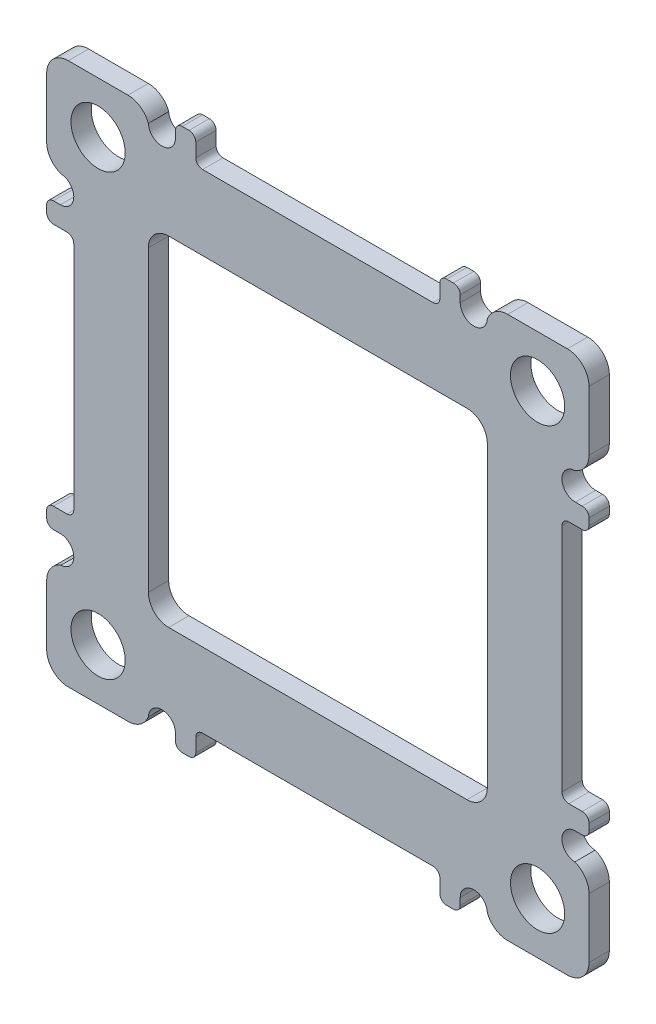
SolidWorks part; units mm, degrees
ref_plane "Front Plane" through (0, 0, 0) normal (0, 0, 1) x (1, 0, 0)
ref_plane "Top Plane" through (0, 0, 0) normal (0, 1, 0) x (1, 0, 0)
ref_plane "Right Plane" through (0, 0, 0) normal (1, 0, 0) x (0, 0, -1)
sketch "Sketch1" plane through (0, 0, 0) normal (0, 0, 1) x (1, 0, 0)
  line L0 (0, 0) -> (-40, -40) construction
  line L1 (-36.8039, 40) -> (-27.448, 40)
  line L2 (-40, 36.8039) -> (-40, 28.0026)
  line L3 (40, 20.0026) -> (40, 19.0026)
  line L4 (40, 36.8039) -> (40, 28.0026)
  line L5 (0, -40) -> (0, 40) construction
  line L6 (-40, 0) -> (40, 0) construction
  line L7 (22, 25) -> (-22, 25)
  line L8 (25, 22) -> (25, -22)
  line L9 (37, 18.0026) -> (39, 18.0026)
  line L10 (-25, 22) -> (-25, -22)
  line L11 (0, -25) -> (0, 25) construction
  line L12 (25, 0) -> (-25, 0) construction
  line L13 (37.9885, 21.0026) -> (39, 21.0026)
  line L14 (27.4643, 40) -> (36.8039, 40)
  line L15 (-20.0026, 40) -> (-19.0026, 40)
  line L16 (-36, 17.0026) -> (-36, -17.0026)
  line L17 (-18.0026, 37) -> (-18.0026, 39)
  line L18 (36, 17.0026) -> (36, -17.0026)
  line L19 (-21.0026, 37.9885) -> (-21.0026, 39)
  line L20 (21.0026, 37.9885) -> (21.0026, 39)
  line L21 (-17.0026, 36) -> (17.0026, 36)
  line L22 (18.0026, 37) -> (18.0026, 39)
  line L23 (20.0026, 40) -> (19.0026, 40)
  line L24 (-40, -20.0026) -> (-40, -19.0026)
  line L25 (-37, -18.0026) -> (-39, -18.0026)
  line L26 (-37.9885, -21.0026) -> (-39, -21.0026)
  line L27 (20.0026, -40) -> (19.0026, -40)
  line L28 (18.0026, -37) -> (18.0026, -39)
  line L29 (-17.0026, -36) -> (17.0026, -36)
  line L30 (-37.9885, 21.0026) -> (-39, 21.0026)
  line L31 (21.0026, -37.9885) -> (21.0026, -39)
  line L32 (-37, 18.0026) -> (-39, 18.0026)
  line L33 (-40, 20.0026) -> (-40, 19.0026)
  line L34 (-21.0026, -37.9885) -> (-21.0026, -39)
  line L35 (-18.0026, -37) -> (-18.0026, -39)
  line L36 (-20.0026, -40) -> (-19.0026, -40)
  line L37 (27.4643, -40) -> (36.8039, -40)
  line L38 (37.9885, -21.0026) -> (39, -21.0026)
  line L39 (37, -18.0026) -> (39, -18.0026)
  line L40 (22, -25) -> (-22, -25)
  line L41 (40, -36.8039) -> (40, -28.0026)
  line L42 (40, -20.0026) -> (40, -19.0026)
  line L43 (-40, -36.8039) -> (-40, -28.0026)
  line L44 (-36.8039, -40) -> (-27.448, -40)
  arc A0 (-37.9847, 21.0026) -> (-37.8992, 25) centre (-38, 23.0025) ccw
  arc A1 (37.9885, 21.0026) -> (37.9847, 21.0026) centre (37.9885, 21.5026) cw
  arc A2 (36, 17.0026) -> (37, 18.0026) centre (37, 17.0026) cw
  arc A3 (39, 21.0026) -> (40, 20.0026) centre (39, 20.0026) cw
  arc A4 (39, 18.0026) -> (40, 19.0026) centre (39, 19.0026) ccw
  arc A5 (40, 28.0026) -> (37.8992, 25) centre (36.8039, 28.0026) cw
  arc A6 (37.9847, 21.0026) -> (37.8992, 25) centre (38, 23.0025) cw
  arc A7 (-21.0026, 37.9885) -> (-21.0026, 37.9847) centre (-21.5026, 37.9885) cw
  arc A8 (21.0026, 37.9847) -> (25, 37.8992) centre (23.0025, 38) ccw
  arc A9 (-17.0026, 36) -> (-18.0026, 37) centre (-17.0026, 37) cw
  arc A10 (-21.0026, 39) -> (-20.0026, 40) centre (-20.0026, 39) cw
  arc A11 (-18.0026, 39) -> (-19.0026, 40) centre (-19.0026, 39) ccw
  arc A12 (37.8992, 25) -> (40, 28.0026) centre (36.8039, 28.0026) ccw
  arc A13 (36.8039, 40) -> (40, 36.8039) centre (36.8039, 36.8039) cw
  arc A14 (-25, 37.8992) -> (-28.0026, 40) centre (-28.0026, 36.8039) ccw
  arc A15 (-21.0026, 37.9847) -> (-25, 37.8992) centre (-23.0025, 38) cw
  arc A16 (21.0026, -37.9885) -> (21.0026, -37.9847) centre (21.5026, -37.9885) cw
  arc A17 (17.0026, -36) -> (18.0026, -37) centre (17.0026, -37) cw
  arc A18 (-40, 28.0026) -> (-37.8992, 25) centre (-36.8039, 28.0026) ccw
  arc A19 (-40, 36.8039) -> (-36.8039, 40) centre (-36.8039, 36.8039) cw
  arc A20 (21.0026, -39) -> (20.0026, -40) centre (20.0026, -39) cw
  arc A21 (25, 22) -> (22, 25) centre (22, 22) ccw
  arc A22 (18.0026, -39) -> (19.0026, -40) centre (19.0026, -39) ccw
  arc A23 (-22, 25) -> (-25, 22) centre (-22, 22) ccw
  arc A24 (-39, 18.0026) -> (-40, 19.0026) centre (-39, 19.0026) cw
  arc A25 (-39, 21.0026) -> (-40, 20.0026) centre (-39, 20.0026) ccw
  arc A26 (-36, 17.0026) -> (-37, 18.0026) centre (-37, 17.0026) ccw
  arc A27 (-37.9885, 21.0026) -> (-37.9847, 21.0026) centre (-37.9885, 21.5026) ccw
  arc A28 (25, 37.8992) -> (28.0026, 40) centre (28.0026, 36.8039) cw
  arc A29 (18.0026, 39) -> (19.0026, 40) centre (19.0026, 39) cw
  arc A30 (21.0026, 39) -> (20.0026, 40) centre (20.0026, 39) ccw
  arc A31 (17.0026, 36) -> (18.0026, 37) centre (17.0026, 37) ccw
  arc A32 (21.0026, 37.9885) -> (21.0026, 37.9847) centre (21.5026, 37.9885) ccw
  arc A33 (25, -37.8992) -> (28.0026, -40) centre (28.0026, -36.8039) ccw
  arc A34 (-37.9885, -21.0026) -> (-37.9847, -21.0026) centre (-37.9885, -21.5026) cw
  arc A35 (-36, -17.0026) -> (-37, -18.0026) centre (-37, -17.0026) cw
  arc A36 (-39, -21.0026) -> (-40, -20.0026) centre (-39, -20.0026) cw
  arc A37 (-39, -18.0026) -> (-40, -19.0026) centre (-39, -19.0026) ccw
  arc A38 (-22, -25) -> (-25, -22) centre (-22, -22) cw
  arc A39 (25, -22) -> (22, -25) centre (22, -22) cw
  arc A40 (-40, -36.8039) -> (-36.8039, -40) centre (-36.8039, -36.8039) ccw
  arc A41 (-40, -28.0026) -> (-37.8992, -25) centre (-36.8039, -28.0026) cw
  arc A42 (-21.0026, -37.9847) -> (-25, -37.8992) centre (-23.0025, -38) ccw
  arc A43 (-25, -37.8992) -> (-28.0026, -40) centre (-28.0026, -36.8039) cw
  arc A44 (36.8039, -40) -> (40, -36.8039) centre (36.8039, -36.8039) ccw
  arc A45 (37.8992, -25) -> (40, -28.0026) centre (36.8039, -28.0026) cw
  arc A46 (-18.0026, -39) -> (-19.0026, -40) centre (-19.0026, -39) cw
  arc A47 (-21.0026, -39) -> (-20.0026, -40) centre (-20.0026, -39) ccw
  arc A48 (-17.0026, -36) -> (-18.0026, -37) centre (-17.0026, -37) ccw
  arc A49 (21.0026, -37.9847) -> (25, -37.8992) centre (23.0025, -38) cw
  arc A50 (-21.0026, -37.9885) -> (-21.0026, -37.9847) centre (-21.5026, -37.9885) ccw
  arc A51 (37.9847, -21.0026) -> (37.8992, -25) centre (38, -23.0025) ccw
  arc A52 (40, -28.0026) -> (37.8992, -25) centre (36.8039, -28.0026) ccw
  arc A53 (39, -18.0026) -> (40, -19.0026) centre (39, -19.0026) cw
  arc A54 (39, -21.0026) -> (40, -20.0026) centre (39, -20.0026) ccw
  arc A55 (36, -17.0026) -> (37, -18.0026) centre (37, -17.0026) ccw
  arc A56 (37.9885, -21.0026) -> (37.9847, -21.0026) centre (37.9885, -21.5026) ccw
  arc A57 (-37.9847, -21.0026) -> (-37.8992, -25) centre (-38, -23.0025) cw
  point P0 (0, 0)
  point P1 (-36, 0)
  point P4 (0, 0)
  point P27 (-37, 25)
  point P30 (40, -25)
  point P34 (40, 21.0026)
  point P36 (40, 18.0026)
  point P41 (-25, -40)
  point P47 (-40, -25)
  point P50 (-25, -37)
  point P53 (-37, -25)
  point P54 (-21.0026, 40)
  point P55 (-18.0026, 40)
  point P56 (37, -25)
  point P57 (-25, 37)
  point P59 (37, 25)
  point P60 (-25, 40)
  point P62 (40, 25)
  point P74 (-25, 37)
  point P77 (-25, 40)
  point P80 (-40, 25)
  point P83 (-40, 40)
  point P88 (25, 25)
  point P91 (-25, -25)
  point P94 (-25, 25)
  point P101 (-40, 18.0026)
  point P104 (-40, 21.0026)
  point P116 (25, 40)
  point P117 (25, 37)
  point P118 (18.0026, 40)
  point P119 (21.0026, 40)
  point P192 (36, 0)
  point P194 (21.0026, -40)
  point P195 (18.0026, -40)
  point P196 (25, -37)
  point P197 (25, -40)
  point P198 (-40, -21.0026)
  point P199 (-40, -18.0026)
  point P200 (25, -25)
  point P201 (-18.0026, -40)
  point P202 (-21.0026, -40)
  point P203 (40, -18.0026)
  point P204 (40, -21.0026)
  dimension "D7" = 2
  dimension "D8" = 25
  dimension "D9" = 25
  dimension "D13" = 1
  dimension "D11" = 1
  dimension "D6" = 50
  dimension "D19" = 0.5
  dimension "D3" = 10
  dimension "D1" = 40
  dimension "D2" = 80
  dimension "D4" = 50
  dimension "D5" = 50
  dimension "D10" = 72
  dimension "D12" = 3
  dimension "D14" = 15
  dimension "D15" = 2
extrude "Boss-Extrude1" add sketch "Sketch1" along normal blind 3 contours A34 A57 A41 L43 A40 L44 A43 A42 A50 L34 A47 L36 A46 L35 A48 L29 A17 L28 A22 L27 A20 L31 A16 A49 A33 L37 A44 L41 A45 A51 A56 L38 A54 L42 A53 L39 A55 L18 A2 L9 A4 L3 A3 L13 A1 A6 A5 L4 A13 L14 A28
sketch "Sketch2" plane through (0, 0, 3) normal (0, 0, 1) x (1, 0, 0)
  line L0 (0, 36) -> (0, -36) construction
  line L1 (-17.0026, 36) -> (17.0026, 36) construction
  line L2 (-17.0026, -36) -> (17.0026, -36) construction
  line L3 (0, 0) -> (-39.0639, -39.0639) construction
  line L4 (36, 0) -> (-36, 0) construction
  line L5 (36, 17.0026) -> (36, -17.0026) construction
  line L6 (-36, 17.0026) -> (-36, -17.0026) construction
  circle A0 centre (-32.4147, 32.4147) radius 4
  arc A1 (-40, -36.8039) -> (-36.8039, -40) centre (-36.8039, -36.8039) ccw construction
  circle A2 centre (32.4147, 32.4147) radius 4
  circle A3 centre (-32.4147, -32.4147) radius 4
  circle A4 centre (32.4147, -32.4147) radius 4
  dimension "D1" = 8
extrude "Cut-Extrude1" cut sketch "Sketch2" against normal blind 3
